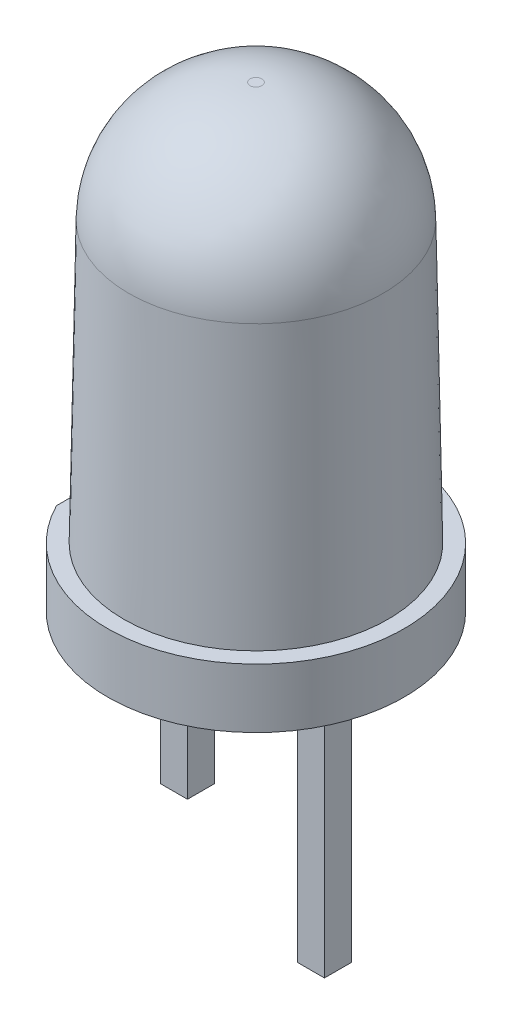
SolidWorks part; units mm, degrees
ref_plane "Front Plane" through (0, 0, 0) normal (0, 0, 1) x (1, 0, 0)
ref_plane "Top Plane" through (0, 0, 0) normal (0, 1, 0) x (1, 0, 0)
ref_plane "Right Plane" through (0, 0, 0) normal (1, 0, 0) x (0, 0, -1)
sketch "Sketch1" plane through (0, 0, 0) normal (0, 1, 0) x (1, 0, 0)
  circle A0 centre (0, 0) radius 2.75
  dimension "D1" = 5.5
extrude "Boss-Extrude1" add sketch "Sketch1" along normal blind 1.1 contours A0
sketch "Sketch2" plane through (0, 1.1, 0) normal (0, 1, 0) x (1, 0, 0)
  circle A0 centre (0, 0) radius 2.45
  dimension "D1" = 4.9
ref_plane "Plane1" through (0, 8.5, 0) normal (0, -1, 0) x (-1, 0, 0)
sketch "Sketch3" plane through (0, 0, 0) normal (0, 0, 1) x (1, 0, 0)
  line L0 (0, 1.1) -> (0, 8.5)
  line L2 (-3.025, 8.5) -> (3.025, 8.5) construction
sweep "Sweep1" add profiles "Sketch2" path "Sketch3"
draft "Draft1" type of draft neutral plane draft angle 1 faces to draft 1 parameters "D1"=1
fillet "Fillet1" radius 2.25 1 edges at (0, 8.5, 2.3208)
sketch "Sketch5" plane through (0, 1.1, 0) normal (0, 1, 0) x (1, 0, 0)
  line L0 (-2.45, 1.249) -> (-2.45, -1.249)
  circle A1 centre (0, 0) radius 2.45 construction
  circle A2 centre (0, 0) radius 2.75 construction
  arc A3 (-2.45, 1.249) -> (-2.45, -1.249) centre (0, 0) ccw
extrude "Cut-Extrude1" cut sketch "Sketch5" against normal blind 1.1
sketch "Sketch6" plane through (0, 0, 0) normal (0, -1, 0) x (1, 0, 0)
  line L0 (-2.2943, 0) -> (2.578, 0) construction
  line L1 (-1.52, 0.25) -> (-1.02, 0.25)
  line L2 (-1.52, 0.25) -> (-1.52, -0.25)
  line L3 (-1.52, -0.25) -> (-1.02, -0.25)
  line L4 (-1.02, 0.25) -> (-1.02, -0.25)
  line L5 (-1.52, 0.25) -> (-1.02, -0.25) construction
  line L6 (-1.52, -0.25) -> (-1.02, 0.25) construction
  line L7 (1.02, 0.25) -> (1.52, 0.25)
  line L8 (1.02, 0.25) -> (1.02, -0.25)
  line L9 (1.02, -0.25) -> (1.52, -0.25)
  line L10 (1.52, 0.25) -> (1.52, -0.25)
  line L11 (1.02, 0.25) -> (1.52, -0.25) construction
  line L12 (1.02, -0.25) -> (1.52, 0.25) construction
  line L13 (0, 1.1407) -> (0, -1.4584) construction
  point P0 (-1.27, 0)
  point P5 (1.27, 0)
  dimension "D1" = 0.5
  dimension "D2" = 0.5
  dimension "D3" = 2.54
extrude "Boss-Extrude2" add sketch "Sketch6" along normal blind 5
other "Move Face1" parameters "D1"=1.6
sketch "Esquisse1" plane through (0, 0, 0) normal (0, -1, 0) x (1, 0, 0)
  line L0 (-1.02, -0.25) -> (-1.52, 0.25)
  line L1 (-1.02, 0.25) -> (-1.52, 0.25) construction
  line L2 (-1.52, 0.25) -> (-1.52, -0.25) construction
  line L3 (1.52, -0.25) -> (1.02, 0.25)
  circle A0 centre (-1.27, 0) radius 0.5
  circle A1 centre (1.27, 0) radius 0.5
  dimension "D1" = 1
  dimension "D2" = 1
